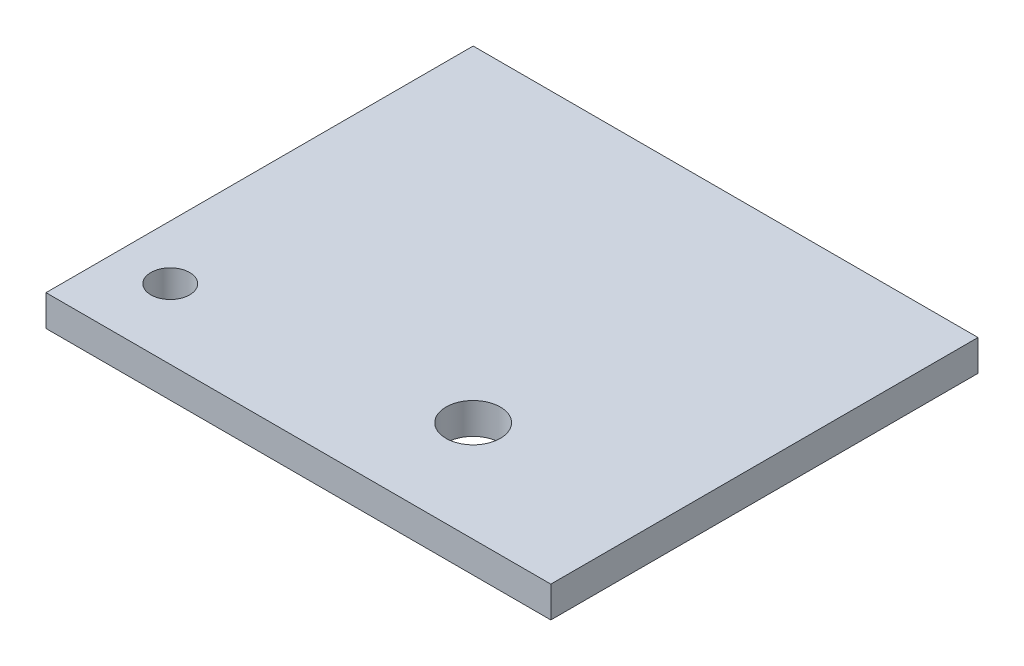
SolidWorks part; units mm, degrees
ref_plane "Front" through (0, 0, 0) normal (0, 0, 1) x (1, 0, 0)
ref_plane "Top" through (0, 0, 0) normal (0, 1, 0) x (1, 0, 0)
ref_plane "Right" through (0, 0, 0) normal (1, 0, 0) x (0, 0, -1)
sketch "Sketch1" plane through (0, 0, 0) normal (0, 1, 0) x (1, 0, 0)
  line L1 (0, 0) -> (325, 0)
  line L2 (0, 0) -> (0, 275)
  line L3 (0, 275) -> (325, 275)
  line L4 (325, 0) -> (325, 275)
  dimension "D1" = 325
  dimension "D2" = 275
extrude "Plate" add sketch "Sketch1" along normal blind 20
other "D25"
sketch "Sketch4" plane through (0, 20, 0) normal (0, 1, 0) x (-1, 0, 0)
  line L0 (0, -275) -> (0, 0) construction
  line L1 (0, 0) -> (-325, 0) construction
  circle A0 centre (-35, -45) radius 12.5
  dimension "D1" = 25
  dimension "D2" = 35
  dimension "D3" = 45
sketch "Sketch5" plane through (147.954, 20, -60.8892) normal (0, 1, 0) x (-1, 0, 0)
  line L2 (147.954, 60.8892) -> (-177.046, 60.8892) construction
  line L3 (147.954, -214.1108) -> (147.954, 60.8892) construction
  circle A0 centre (-62.046, -4.1108) radius 17.5
  dimension "D1" = 35
  dimension "D2" = 65
  dimension "D3" = 210
other "D35"
